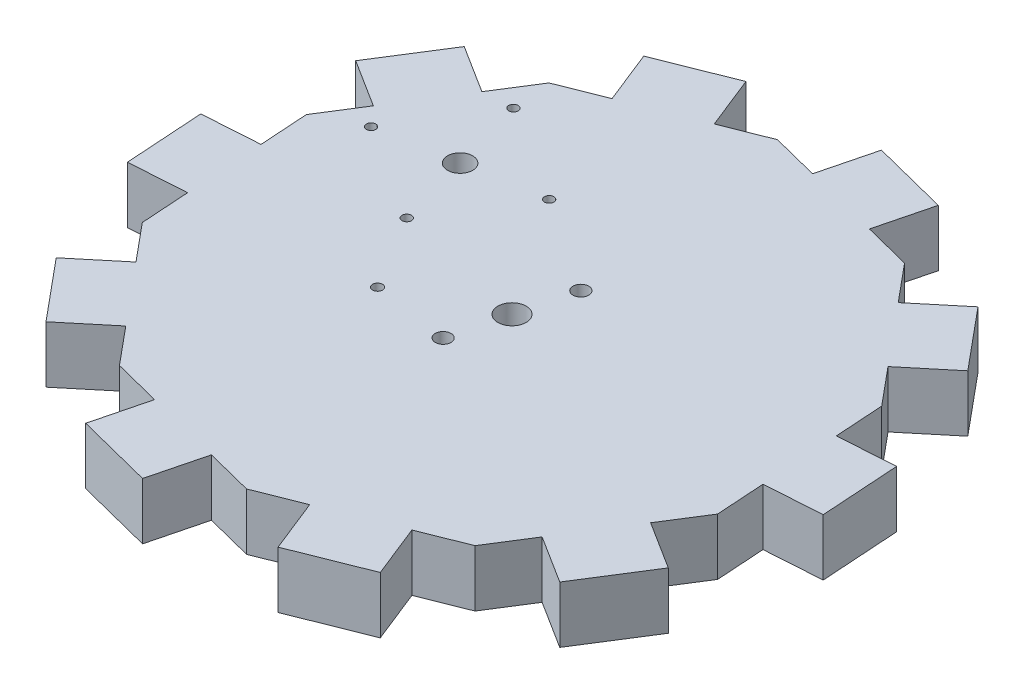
SolidWorks part; units mm, degrees
ref_plane "Front Plane" through (0, 0, 0) normal (0, 0, 1) x (1, 0, 0)
ref_plane "Top Plane" through (0, 0, 0) normal (0, 1, 0) x (1, 0, 0)
ref_plane "Right Plane" through (0, 0, 0) normal (1, 0, 0) x (0, 0, -1)
sketch "Sketch1" plane through (0, 0, 0) normal (0, 1, 0) x (1, 0, 0)
  line L0 (-27.5215, 77.4473) -> (26.6328, 63.686)
  line L3 (-35.6207, 79.5066) -> (20.2031, 65.3128) construction
  line L5 (-33.6924, 74.9873) -> (-19.7587, 80.5419) construction
  line L7 (-27.5215, 77.4473) -> (-79.4349, 56.7525)
  line L9 (-87.1977, 53.658) -> (-33.6924, 74.9873) construction
  line L11 (62.3653, 20.6983) -> (26.6328, 63.686)
  line L12 (58.1188, 25.8069) -> (67.7072, 14.2717) construction
  line L13 (-15.7302, -103.0235) -> (36.1703, -82.3255)
  line L15 (43.9331, -79.231) -> (-9.5722, -100.5603) construction
  line L17 (39.7167, -76.7083) -> (31.709, -89.392) construction
  line L19 (-69.9059, -89.2488) -> (-15.7302, -103.0235)
  line L22 (36.1703, -82.3255) -> (66.005, -35.0692)
  line L23 (70.4663, -28.0028) -> (39.7167, -76.7083) construction
  line L24 (65.5724, -28.4403) -> (66.5493, -43.4084) construction
  line L25 (66.005, -35.0692) -> (62.3653, 20.6983)
  line L26 (61.821, 29.0375) -> (65.5724, -28.4403) construction
  line L27 (21.2993, 70.1024) -> (58.1188, 25.8069) construction
  line L28 (-82.9813, 51.1353) -> (-74.9735, 63.819) construction
  line L29 (-79.4349, 56.7525) -> (-109.2696, 9.4963)
  line L30 (-113.7309, 2.4298) -> (-82.9813, 51.1353) construction
  line L31 (-108.8369, 2.8673) -> (-109.8138, 17.8354) construction
  line L32 (-109.2696, 9.4963) -> (-105.6298, -46.2713)
  line L33 (-105.0855, -54.6104) -> (-108.8369, 2.8673) construction
  line L34 (-101.3834, -51.3799) -> (-110.9718, -39.8447) construction
  line L35 (-105.6298, -46.2713) -> (-69.9059, -89.2488)
  line L36 (-64.5639, -95.6754) -> (-101.3834, -51.3799) construction
extrude "Boss-Extrude1" add sketch "Sketch1" along normal blind 18
sketch "Sketch2" plane through (0, 18, 0) normal (0, 1, 0) x (1, 0, 0)
  circle A0 centre (-17.1967, 4.6584) radius 2.5
  circle A1 centre (-21.6323, -12.7865) radius 4.5
  circle A2 centre (-26.0678, -30.2314) radius 2.5
  dimension "D1" = 9
extrude "Cut-Extrude1" cut sketch "Sketch2" against normal through all
sketch "Sketch3" plane through (0, 0, 0) normal (0, -1, 0) x (1, 0, 0)
  line L0 (-21.6323, 12.7865) -> (-17.1967, -4.6584) construction
  line L1 (-21.6323, 12.7865) -> (-73.711, 0) construction
  line L2 (-28.5356, 8.1661) -> (-79.5546, -25.9811) construction
  circle A0 centre (-71.4945, -20.5865) radius 11
  point P1 (-21.6323, 12.7865)
  dimension "D2" = 60
  dimension "D3" = 22
  dimension "D1" = 20
extrude "Cut-Extrude2" cut sketch "Sketch3" against normal blind 12
sketch "Sketch4" plane through (0, 0, 0) normal (0, -1, 0) x (1, 0, 0)
  line L0 (-35.6692, 9.2175) -> (-40.1047, 26.6624) construction
  line L1 (-95.0938, -22.5437) -> (-72.6722, -58.0581) construction
  line L2 (-100.4625, -14.0401) -> (-131.5146, -33.6444) construction
  line L3 (-64.9481, 8.3815) -> (-100.4625, -14.0401)
  line L4 (-78.0409, -49.5545) -> (-100.4625, -14.0401)
  line L5 (-64.9481, 8.3815) -> (-78.0409, -49.5545) construction
  line L6 (-78.0409, -49.5545) -> (-42.5265, -27.1329)
  line L7 (-21.6323, 12.7865) -> (-46.9034, 6.361) construction
  line L8 (-79.4349, -56.7525) -> (-109.2696, -9.4963) construction
  line L9 (-64.9481, 8.3815) -> (-42.5265, -27.1329)
  point P0 (-71.4945, -20.5865)
  point P1 (-71.4945, -20.5865)
  point P3 (-71.4945, -20.5865)
  point P17 (-71.4945, -20.5865)
  dimension "D1" = 42
  dimension "D2" = 90
  dimension "D3" = 42
  dimension "D4" = 90
  dimension "D5" = 90
extrude "Cut-Extrude3" cut sketch "Sketch4" against normal blind 10
fillet "Fillet1" radius 2 4 edges at (-64.9481, 5, 8.3815) (-100.4625, 5, -14.0401) (-78.0409, 5, -49.5545) (-42.5265, 5, -27.1329)
sketch "Sketch5" plane through (0, 12, 0) normal (0, -1, 0) x (1, 0, 0)
  circle A0 centre (-71.4945, -20.5865) radius 4
  dimension "D1" = 8
extrude "Cut-Extrude4" cut sketch "Sketch5" against normal through all
sketch "Sketch6" plane through (0, 10, 0) normal (0, -1, 0) x (1, 0, 0)
  line L0 (-68.5857, -18.75) -> (-50.8285, -7.5392) construction
  line L2 (-71.4945, -20.5865) -> (-60.2837, -38.3437) construction
  circle A0 centre (-47.3499, -24.738) radius 1.5
  circle A1 centre (-78.129, -44.17) radius 1.5
  circle A2 centre (-95.6392, -16.435) radius 1.5
  circle A3 centre (-64.8601, 2.9971) radius 1.5
  point P10 (-51.0595, -25.3061)
  dimension "D1" = 3
  dimension "D2" = 16.4
  dimension "D3" = 18.2
extrude "Cut-Extrude5" cut sketch "Sketch6" against normal through all
sketch "Sketch7" plane through (0, 0, 0) normal (0, -1, 0) x (1, 0, 0)
  line L0 (-21.6323, 12.7865) -> (-17.1967, -4.6584) construction
  line L1 (-21.6323, 12.7865) -> (-42.877, 7.3848) construction
  line L2 (-21.6323, 12.7865) -> (-50.4585, 26.6808) construction
  circle A0 centre (-21.6323, 12.7865) radius 10 construction
  circle A1 centre (-21.6323, 12.7865) radius 32 construction
  circle A2 centre (-50.4585, 26.6808) radius 1.6
  point P4 (-21.6323, 12.7865)
  point P14 (0, 0)
  dimension "D1" = 20
  dimension "D2" = 22
  dimension "D3" = 3.2
  dimension "D4" = 40
extrude "Cut-Extrude6" cut sketch "Sketch7" against normal through all both and the other way through all
sketch "Sketch8" plane through (0, 0, 0) normal (0, -1, 0) x (1, 0, 0)
  circle A0 centre (-50.4585, 26.6808) radius 3
  dimension "D1" = 6
extrude "Cut-Extrude7" cut sketch "Sketch8" against normal blind 10
sketch "Sketch9" plane through (0, 18, 0) normal (0, 1, 0) x (1, 0, 0)
  line L0 (-101.0253, 22.5546) -> (-87.6791, 43.6942)
  line L1 (-79.4349, 56.7525) -> (-109.2696, 9.4963) construction
  line L2 (-21.6323, -12.7865) -> (-94.3522, 33.1244) construction
  line L3 (-87.6791, 43.6942) -> (-102.8996, 53.3034)
  line L4 (-101.0253, 22.5546) -> (-116.2458, 32.1639)
  line L5 (-102.8996, 53.3034) -> (-116.2458, 32.1639)
  line L6 (-65.0896, 62.4711) -> (-41.8668, 71.7287)
  line L7 (-65.0896, 62.4711) -> (-71.755, 79.1916)
  line L8 (-48.5322, 88.4491) -> (-71.755, 79.1916)
  line L9 (-41.8668, 71.7287) -> (-48.5322, 88.4491)
  line L10 (-12.5547, 73.6418) -> (11.6744, 67.4813)
  line L11 (-12.5547, 73.6418) -> (-8.1191, 91.0867)
  line L12 (16.11, 84.9262) -> (-8.1191, 91.0867)
  line L13 (11.6744, 67.4813) -> (16.11, 84.9262)
  line L14 (36.5129, 51.7998) -> (52.4936, 32.5743)
  line L15 (36.5129, 51.7998) -> (50.3553, 63.3058)
  line L16 (66.3359, 44.0804) -> (50.3553, 63.3058)
  line L17 (52.4936, 32.5743) -> (66.3359, 44.0804)
  line L18 (63.371, 5.288) -> (64.9992, -19.6589)
  line L19 (63.371, 5.288) -> (81.3328, 6.4603)
  line L20 (82.961, -18.4866) -> (81.3328, 6.4603)
  line L21 (64.9992, -19.6589) -> (82.961, -18.4866)
  line L22 (57.7608, -48.1276) -> (44.4146, -69.2671)
  line L23 (57.7608, -48.1276) -> (72.9812, -57.7369)
  line L24 (59.635, -78.8764) -> (72.9812, -57.7369)
  line L25 (44.4146, -69.2671) -> (59.635, -78.8764)
  line L26 (21.825, -88.0441) -> (-1.3978, -97.3017)
  line L27 (21.825, -88.0441) -> (28.4905, -104.7645)
  line L28 (5.2677, -114.0221) -> (28.4905, -104.7645)
  line L29 (-1.3978, -97.3017) -> (5.2677, -114.0221)
  line L30 (-30.7099, -99.2148) -> (-54.939, -93.0543)
  line L31 (-30.7099, -99.2148) -> (-35.1455, -116.6597)
  line L32 (-59.3745, -110.4992) -> (-35.1455, -116.6597)
  line L33 (-54.939, -93.0543) -> (-59.3745, -110.4992)
  line L34 (-79.7775, -77.3727) -> (-95.7582, -58.1473)
  line L35 (-79.7775, -77.3727) -> (-93.6198, -88.8788)
  line L36 (-109.6005, -69.6534) -> (-93.6198, -88.8788)
  line L37 (-95.7582, -58.1473) -> (-109.6005, -69.6534)
  line L38 (-106.6356, -30.861) -> (-108.2638, -5.914)
  line L39 (-106.6356, -30.861) -> (-124.5974, -32.0333)
  line L40 (-126.2256, -7.0863) -> (-124.5974, -32.0333)
  line L41 (-108.2638, -5.914) -> (-126.2256, -7.0863)
  point P0 (-21.6323, -12.7865)
  point P7 (-94.3522, 33.1244)
  point P50 (-21.6323, -12.7865)
  dimension "D1" = 25
  dimension "D2" = 90
  dimension "D3" = 18
  dimension "D4" = 25
  dimension "D5" = 10
extrude "Boss-Extrude2" add sketch "Sketch9" against normal up to surface (18 mm away)
